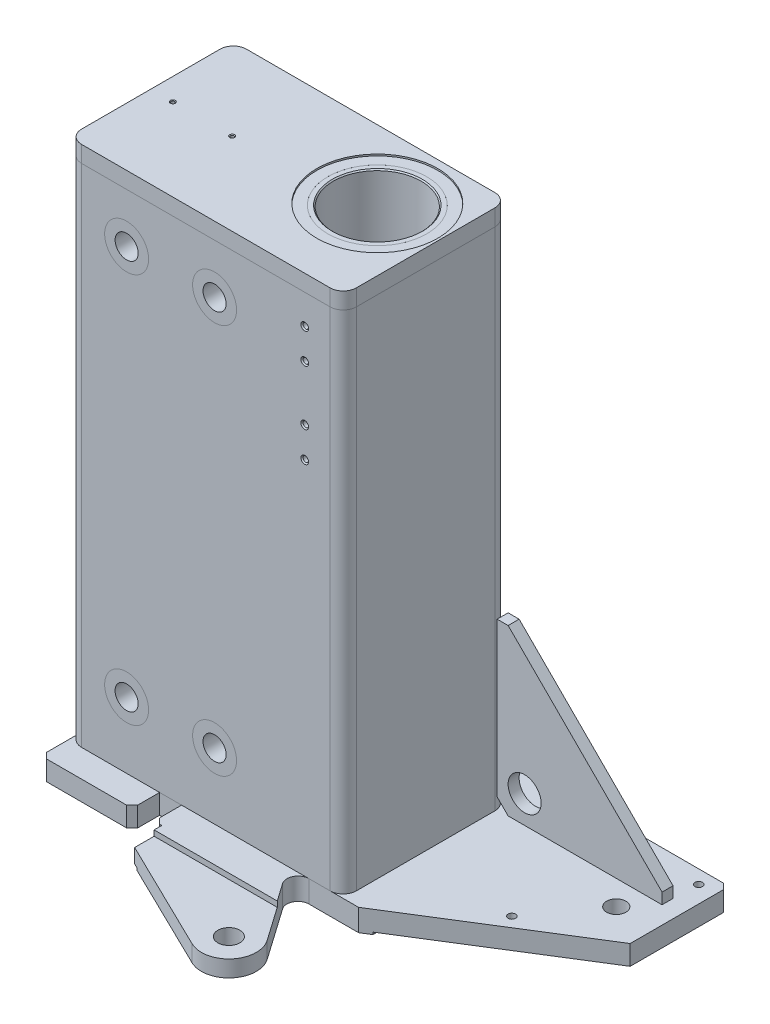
SolidWorks part; units mm, degrees
ref_plane "Face" through (0, 0, 0) normal (0, 0, 1) x (1, 0, 0)
ref_plane "Dessus" through (0, 0, 0) normal (0, 1, 0) x (1, 0, 0)
ref_plane "Droite" through (0, 0, 0) normal (1, 0, 0) x (0, 0, -1)
sketch "Esquisse1" plane through (0, 0, 0) normal (0, 1, 0) x (1, 0, 0)
  line L0 (125, 75) -> (-125, -75) construction
  line L1 (-113, 75) -> (113, 75)
  line L2 (-125, 63) -> (-125, -63)
  line L3 (-113, -75) -> (113, -75)
  line L4 (125, 63) -> (125, -63)
  line L6 (-113, 69) -> (113, 69)
  line L7 (-119, 63) -> (-119, -63)
  line L8 (-113, -69) -> (113, -69)
  line L9 (119, 63) -> (119, -63)
  arc A0 (-119, 63) -> (-113, 69) centre (-113, 63) cw
  arc A1 (119, 63) -> (113, 69) centre (113, 63) ccw
  arc A2 (113, -69) -> (119, -63) centre (113, -63) ccw
  arc A3 (-113, -69) -> (-119, -63) centre (-113, -63) cw
  arc A4 (-125, 63) -> (-113, 75) centre (-113, 63) cw
  arc A5 (-113, -75) -> (-125, -63) centre (-113, -63) cw
  arc A6 (125, -63) -> (113, -75) centre (113, -63) cw
  arc A7 (113, 75) -> (125, 63) centre (113, 63) cw
  dimension "D7" = 6
  dimension "D8" = 12
  dimension "D1" = 250
  dimension "D2" = 150
  dimension "D3" = 6
  dimension "D4" = 6
  dimension "D5" = 6
  dimension "D6" = 6
extrude "Extrusion1" add sketch "Esquisse1" against normal blind 460
sketch "Esquisse2" plane through (0, 0, 0) normal (0, 1, 0) x (-1, 0, 0)
  line L4 (125, -63) -> (125, 63)
  line L5 (113, 75) -> (-113, 75)
  line L6 (-125, 63) -> (-125, -63)
  line L7 (-113, -75) -> (113, -75)
  line L8 (125, -63) -> (125, 63)
  line L9 (113, 75) -> (-113, 75)
  line L10 (-125, 63) -> (-125, -63)
  line L11 (-113, -75) -> (113, -75)
  circle A0 centre (-68, -13) radius 45
  arc A4 (113, -75) -> (125, -63) centre (113, -63) ccw
  arc A5 (125, 63) -> (113, 75) centre (113, 63) ccw
  arc A6 (-113, 75) -> (-125, 63) centre (-113, 63) ccw
  arc A7 (-125, -63) -> (-113, -75) centre (-113, -63) ccw
  arc A8 (113, -75) -> (125, -63) centre (113, -63) ccw
  arc A9 (125, 63) -> (113, 75) centre (113, 63) ccw
  arc A10 (-113, 75) -> (-125, 63) centre (-113, 63) ccw
  arc A11 (-125, -63) -> (-113, -75) centre (-113, -63) ccw
  dimension "D2" = 90
  dimension "D3" = 68
  dimension "D4" = 88
  dimension "D1" = 0
extrude "Extrusion2" add sketch "Esquisse2" along normal blind 15 separate body
sketch "Esquisse3" plane through (0, -460, 0) normal (0, -1, 0) x (1, 0, 0)
  line L0 (-113, -75) -> (15.8579, -75)
  line L1 (113, -75) -> (-113, -75) construction
  line L2 (-125, 100) -> (-67.9538, 100)
  line L3 (-63.5701, 101.0121) -> (87.0407, 174.4699)
  line L4 (-113, -75) -> (113, -75)
  line L5 (125, -63) -> (125, 63)
  line L6 (113, 75) -> (-113, 75)
  line L7 (-125, 63) -> (-125, -63)
  line L8 (291, -20) -> (291, -110)
  line L9 (93.8132, 75) -> (138.9682, 75)
  line L10 (118.4788, 137.6606) -> (85.6217, 90.7358)
  line L11 (-125, 100) -> (-125, -63)
  line L12 (138.9682, 75) -> (291, -20)
  line L13 (22.9289, -77.9289) -> (55, -110)
  line L14 (55, -110) -> (291, -110)
  circle A0 centre (68, -13) radius 45 construction
  circle A1 centre (68, -13) radius 45
  arc A2 (-113, -75) -> (-125, -63) centre (-113, -63) cw
  arc A3 (-63.5701, 101.0121) -> (-67.9538, 100) centre (-67.9538, 110) cw
  arc A4 (-125, -63) -> (-113, -75) centre (-113, -63) ccw
  arc A5 (113, -75) -> (125, -63) centre (113, -63) ccw
  arc A6 (125, 63) -> (113, 75) centre (113, 63) ccw
  arc A7 (-113, 75) -> (-125, 63) centre (-113, 63) ccw
  arc A8 (93.8132, 75) -> (85.6217, 90.7358) centre (93.8132, 85) cw
  circle A9 centre (98, 152) radius 10
  arc A10 (118.4788, 137.6606) -> (87.0407, 174.4699) centre (98, 152) ccw
  arc A11 (22.9289, -77.9289) -> (15.8579, -75) centre (15.8579, -85) ccw
  point P28 (-65.6451, 100)
  point P39 (20, -75)
  dimension "D2" = 12
  dimension "D3" = 165
  dimension "D6" = 20
  dimension "D5" = 25
  dimension "D10" = 150
  dimension "D8" = 10
  dimension "D7" = 10
  dimension "D18" = 10
  dimension "D4" = 175
  dimension "D9" = 30
  dimension "D11" = 223
  dimension "D12" = 55
  dimension "D13" = 55
  dimension "D14" = 32
  dimension "D15" = 145
  dimension "D16" = 135
  dimension "D17" = 210
  dimension "D19" = 29
  dimension "D1" = 0
extrude "Extrusion3" add sketch "Esquisse3" along normal blind 20 separate body
sketch "Esquisse21" plane through (0, 15, 0) normal (0, 1, 0) x (-1, 0, 0)
  point P0 (-68, -13)
ref_plane "Plan1" through (0, 0, -13) normal (0, 0, 1) x (1, 0, 0)
sketch "Esquisse4" plane through (0, 0, -13) normal (0, 0, 1) x (1, 0, 0)
  line L0 (68, -415) -> (68, -522.3182) construction
  line L1 (-67.9538, -480) -> (-125, -480) construction
  line L2 (-113, 15) -> (113, 15) construction
  line L3 (20.5, 0) -> (20.5, -460)
  line L4 (23, -480) -> (28, -480)
  line L5 (87.0407, -460) -> (-63.5701, -460) construction
  line L6 (20.5, -460) -> (23, -460)
  line L7 (28, 15) -> (23, 15)
  line L8 (28, 15) -> (28, -45)
  line L9 (28, -45) -> (29.5, -45)
  line L10 (29.5, -45) -> (29.5, -420)
  line L11 (29.5, -420) -> (28, -420)
  line L12 (28, -420) -> (28, -480)
  line L13 (-113, 0) -> (113, 0) construction
  line L15 (23, -460) -> (23, -480)
  line L17 (20.5, 0) -> (23, 0)
  line L18 (23, 15) -> (23, 0)
  dimension "D1" = 68
  dimension "D2" = 60
  dimension "D3" = 60
  dimension "D4" = 80
  dimension "D5" = 95
  dimension "D6" = 77
  dimension "D7" = 90
revolve "Révolution1" add sketch "Esquisse4" angle 360 about L0
sketch "Esquisse22" plane through (0, 0, -13) normal (0, 0, 1) x (1, 0, 0)
  line L0 (-113, 15) -> (113, 15) construction
  line L1 (17.9, -26) -> (27.9, -26)
  line L2 (17.9, -26) -> (17.9, -64)
  line L3 (17.9, -64) -> (27.9, -64)
  line L4 (27.9, -26) -> (27.9, -64)
  line L6 (17.9, -381) -> (27.9, -381)
  line L7 (17.9, -381) -> (17.9, -419)
  line L8 (17.9, -419) -> (27.9, -419)
  line L9 (27.9, -381) -> (27.9, -419)
  dimension "D1" = 38
  dimension "D2" = 10
  dimension "D3" = 38
  dimension "D4" = 10
  dimension "D5" = 27.9
  dimension "D6" = 41
  dimension "D7" = 317
extrude "Enlèv. mat.-Extru.11" cut sketch "Esquisse22" against normal blind 50 and the other way blind 50
sketch "Esquisse5" plane through (0, 0, 0) normal (0, 0, 1) x (1, 0, 0)
  line L1 (-125, -460) -> (-125, 0) construction
  line L3 (-67.9538, -480) -> (-125, -480) construction
  circle A0 centre (-72, -45) radius 20
  circle A1 centre (8, -45) radius 20
  circle A2 centre (-72, -400) radius 20
  circle A3 centre (8, -400) radius 20
  dimension "D1" = 40
  dimension "D4" = 355
  dimension "D2" = 80
  dimension "D3" = 80
  dimension "D5" = 53
extrude "Enlèv. mat.-Extru.1" cut sketch "Esquisse5" against normal mid plane 150
sketch "Esquisse6" plane through (0, 0, 0) normal (0, 0, 1) x (1, 0, 0)
  circle A0 centre (-72, -45) radius 10.5
  circle A1 centre (8, -45) radius 10.5
  circle A2 centre (-72, -400) radius 10.5
  circle A3 centre (8, -400) radius 10.5
  circle A4 centre (-72, -45) radius 20 construction
  circle A5 centre (8, -45) radius 20 construction
  circle A6 centre (8, -400) radius 20 construction
  circle A7 centre (-72, -400) radius 20 construction
  circle A8 centre (-72, -45) radius 20
  circle A9 centre (8, -45) radius 20
  circle A10 centre (8, -400) radius 20
  circle A11 centre (-72, -400) radius 20
  dimension "D1" = 21
  dimension "D2" = 21
  dimension "D3" = 21
  dimension "D4" = 21
extrude "Extrusion4" add sketch "Esquisse6" along normal mid plane 150 separate body
chamfer "Chanfrein1" distance 5 angle 45 2 edges at (-125, -470, 100) (291, -470, -110)
sketch "Esquisse7" plane through (0, -460, 0) normal (0, -1, 0) x (1, 0, 0)
  line L0 (97.01, 107) -> (-51.293, 107)
  line L2 (87.0407, 174.4699) -> (-63.5701, 101.0121) construction
  line L3 (85.6217, 90.7358) -> (118.4788, 137.6606) construction
  line L4 (97.01, 107) -> (118.4788, 137.6606)
  line L5 (87.0407, 174.4699) -> (-63.5701, 101.0121) construction
  line L8 (87.0407, 174.4699) -> (-51.293, 107)
  arc A1 (118.4788, 137.6606) -> (87.0407, 174.4699) centre (98, 152) ccw construction
  arc A2 (118.4788, 137.6606) -> (87.0407, 174.4699) centre (98, 152) ccw
  dimension "D1" = 45
extrude "Enlèv. mat.-Extru.2" cut sketch "Esquisse7" along normal blind 5 from surface at 0
sketch "Esquisse8" plane through (0, -460, 0) normal (0, 1, 0) x (-1, 0, 0)
  line L0 (67.9538, 100) -> (120, 100) construction
  line L1 (22, 100) -> (42, 100)
  line L2 (22, 100) -> (22, 75)
  line L3 (22, 75) -> (42, 75)
  line L4 (42, 100) -> (42, 75)
  line L5 (113, 75) -> (-113, 75) construction
  line L6 (32, 143.1747) -> (32, 56.8253) construction
  line L7 (72, 75) -> (72, -75) construction
  dimension "D1" = 20
  dimension "D2" = 40
extrude "Enlèv. mat.-Extru.3" cut sketch "Esquisse8" against normal through all
sketch "Esquisse9" plane through (0, 15, 0) normal (0, 1, 0) x (-1, 0, 0)
  circle A0 centre (-68, -13) radius 55
  circle A1 centre (-68, -13) radius 47.5 construction
  dimension "D1" = 110
extrude "Enlèv. mat.-Extru.4" cut sketch "Esquisse9" against normal blind 1.5
sketch "Esquisse10" plane through (0, -480, 0) normal (0, -1, 0) x (1, 0, 0)
  circle A0 centre (68, -13) radius 55
  circle A1 centre (68, -13) radius 47.5 construction
  dimension "D1" = 110
extrude "Enlèv. mat.-Extru.5" cut sketch "Esquisse10" against normal blind 1.5
chamfer "Chanfrein3" distance 1 angle 45 2 edges at (68, 13.5, 27) (68, -478.5, -53)
ref_plane "Plan2" through (68, 0, 0) normal (-1, 0, 0) x (0, 0, 1)
surface "Surface-Décalage1" parameters "D1"=0
other "Enlèv. mat.-Surface1" [suppressed]
sketch "Esquisse13" plane through (0, -480, 0) normal (0, -1, 0) x (1, 0, 0)
  line L0 (-113, -75) -> (15.8579, -75) construction
  line L1 (-125, -75) -> (-11, -75)
  line L2 (-125, -75) -> (-125, 150.8001)
  line L4 (-11, -75) -> (-11, 150.8001)
  line L6 (-125, 95) -> (-125, -63) construction
  line L7 (147, -110) -> (147, 100)
  line L8 (-125, 150.8001) -> (-11, 150.8001)
  line L9 (55, -110) -> (286, -110) construction
  line L10 (147, 100) -> (291, 100)
  line L11 (291, -105) -> (291, -20) construction
  line L12 (55, -110) -> (286, -110) construction
  line L13 (147, -110) -> (291, -110)
  line L15 (291, -110) -> (291, 100)
  circle A0 centre (68, -13) radius 38.5 construction
  dimension "D1" = 79
  dimension "D2" = 79
extrude "Enlèv. mat.-Extru.7" cut sketch "Esquisse13" against normal blind 2
sketch "Esquisse14" plane through (0, -478, 0) normal (0, -1, 0) x (1, 0, 0)
  line L0 (68, -13) -> (-164.512, -13) construction
  line L1 (68, -13) -> (68, 197.8369) construction
  line L2 (-159.34, 22.9636) -> (301.8703, -49.9966) construction
  arc A0 (-81.9709, -68.7561) -> (-71.1946, 65.8978) centre (68, -13) cw construction
  arc A1 (251.0242, 38.0113) -> (238.2829, -97.2837) centre (68, -13) cw construction
  point P4 (-90.0348, 12)
  point P8 (255.6663, -42.6875)
  dimension "D1" = 160
  dimension "D3" = 190
  dimension "D2" = 25
hole_wizard "Trou taraudé M20x2.51" positions "Esquisse3D1" profile "Esquisse15" tap size "M20x2.5" standard "Ansi Métrique"
sketch3d "Esquisse3D1"
  point P0 (-90.0348, -478, 12)
  point P12 (617.5675, -73.1028, 0)
  point P13 (255.6663, -478, -42.6875)
sketch "Esquisse15" plane through (-90.0348, -478, 12) normal (1, 0, 0) x (0, 0, -1)
  line L0 (0, 0) -> (0, 18)
  line L1 (0, 18) -> (8.75, 18)
  line L2 (8.75, 18) -> (8.75, 0)
  line L5 (8.75, 0) -> (0, 0)
  line L11 (0, -6.35) -> (0, 107.95) construction
  dimension "Diamètre du trou pour taraudage jusqu'au prochain" = 17.5
  dimension "Profondeur du trou pour taraudage jusqu'au prochain" = 18
sketch "Esquisse18" plane through (0, -478, 0) normal (0, -1, 0) x (1, 0, 0)
  circle A0 centre (-90.0348, 12) radius 8.75 construction
  point P0 (-110.0348, 67)
  point P1 (-50.0348, -43)
  point P4 (275.6663, -97.6875)
  point P5 (215.6663, 12.3125)
  dimension "D1" = 60
  dimension "D2" = 20
  dimension "D3" = 110
  dimension "D4" = 55
  dimension "D5" = 55
  dimension "D6" = 20
  dimension "D7" = 60
  dimension "D8" = 110
hole_wizard "Trou taraudé M8x1.251" positions "Esquisse3D3" profile "Esquisse19" tap size "M8x1.25" standard "Ansi Métrique"
sketch3d "Esquisse3D3"
  point P0 (-110.0348, -478, 67)
  point P3 (-50.0348, -478, -43)
  point P6 (215.6663, -478, 12.3125)
  point P9 (275.6663, -478, -97.6875)
sketch "Esquisse19" plane through (-110.0348, -478, 67) normal (1, 0, 0) x (0, 0, -1)
  line L0 (0, 0) -> (0, 18)
  line L1 (0, 18) -> (3.4, 18)
  line L2 (3.4, 18) -> (3.4, 0)
  line L5 (3.4, 0) -> (0, 0)
  line L11 (0, -6.35) -> (0, 107.95) construction
  dimension "Diamètre du trou pour taraudage jusqu'au prochain" = 6.8
  dimension "Profondeur du trou pour taraudage jusqu'au prochain" = 18
sketch "Esquisse20" plane through (0, 0, 0) normal (0, 0, 1) x (1, 0, 0)
  line L0 (135, -310) -> (125, -310)
  line L1 (125, -460) -> (125, 0) construction
  line L2 (125, -310) -> (125, -450)
  line L3 (125, -450) -> (135, -460)
  line L4 (138.9682, -460) -> (93.8132, -460) construction
  line L5 (135, -460) -> (275, -460)
  line L6 (275, -450) -> (275, -460)
  line L7 (135, -310) -> (275, -450)
  dimension "D1" = 10
  dimension "D2" = 10
  dimension "D3" = 150
  dimension "D4" = 10
  dimension "D5" = 150
  dimension "D6" = 10
extrude "Extrusion5" add sketch "Esquisse20" against normal blind 10 from offset 65 separate body
sketch "Esquisse23" plane through (0, -460, 0) normal (0, 1, 0) x (-1, 0, 0)
  line L0 (22, 100) -> (22, 132.413)
  line L1 (22, 132.413) -> (61.4163, 132.413)
  line L2 (61.4163, 132.413) -> (77.1698, 100)
  line L3 (67.9538, 100) -> (120, 100) construction
  line L4 (77.1698, 100) -> (22, 100)
extrude "Enlèv. mat.-Extru.12" cut sketch "Esquisse23" against normal through all
chamfer "Chanfrein4" distance 5 angle 45 1 edges at (-42, -469, 100)
hole_wizard "Trou taraudé M41" positions "Esquisse3D5" profile "Esquisse25" tap size "M4" standard "ISO"
sketch3d "Esquisse3D5"
  point P0 (-51, 15, 0)
  point P2 (-105, 15, 0)
  dimension "D1" = 75
  dimension "D2" = 75
  dimension "D3" = 54
  dimension "D4" = 20
sketch "Esquisse25" plane through (-51, 15, 0) normal (1, 0, 0) x (0, 0, 1)
  line L0 (0, 0) -> (0, 14.4914)
  line L1 (0, 14.4914) -> (1.65, 13.5)
  line L2 (1.65, 13.5) -> (1.65, 0.6)
  line L3 (1.65, 0.6) -> (2.25, 0)
  line L5 (2.25, 0) -> (0, 0)
  line L6 (-1.65, 0.6) -> (-2.25, 0) construction
  line L10 (0, 14.4914) -> (-1.65, 13.5) construction
  line L11 (0, -6.35) -> (0, 107.95) construction
  dimension "Diamètre du trou pour taraudage" = 3.3
  dimension "Profondeur du trou pour taraudage" = 13.5
  dimension "Diamètre du fraisage entrant" = 4.5
  dimension "Angle du fraisage entrant" = 90
  dimension "Angle de pointe" = 118
hole_wizard "Trou taraudé M63" positions "Esquisse3D6" profile "Esquisse26" tap size "M6" standard "ISO"
sketch3d "Esquisse3D6"
  point P0 (90, -27, -75)
  point P2 (90, -132, -75)
  dimension "D1" = 42
  dimension "D2" = 35
  dimension "D3" = 105
sketch "Esquisse26" plane through (90, -27, -75) normal (1, 0, 0) x (0, 1, 0)
  line L0 (0, 0) -> (0, 18.5022)
  line L1 (0, 18.5022) -> (2.5, 17)
  line L2 (2.5, 17) -> (2.5, 1)
  line L3 (2.5, 1) -> (3.5, 0)
  line L5 (3.5, 0) -> (0, 0)
  line L6 (-2.5, 1) -> (-3.5, 0) construction
  line L10 (0, 18.5022) -> (-2.5, 17) construction
  line L11 (0, -6.35) -> (0, 107.95) construction
  dimension "Diamètre du trou pour taraudage" = 5
  dimension "Profondeur du trou pour taraudage" = 17
  dimension "Diamètre du fraisage entrant" = 7
  dimension "Angle du fraisage entrant" = 90
  dimension "Angle de pointe" = 118
hole_wizard "Trou taraudé M64" positions "Esquisse3D7" profile "Esquisse27" tap size "M6" standard "ISO"
sketch3d "Esquisse3D7"
  point P0 (90, -27, 75)
  point P2 (90, -132, 75)
  dimension "D1" = 42
  dimension "D2" = 35
  dimension "D3" = 105
sketch "Esquisse27" plane through (90, -27, 75) normal (1, 0, 0) x (0, -1, 0)
  line L0 (0, 0) -> (0, 18.5022)
  line L1 (0, 18.5022) -> (2.5, 17)
  line L2 (2.5, 17) -> (2.5, 1)
  line L3 (2.5, 1) -> (3.5, 0)
  line L5 (3.5, 0) -> (0, 0)
  line L6 (-2.5, 1) -> (-3.5, 0) construction
  line L10 (0, 18.5022) -> (-2.5, 17) construction
  line L11 (0, -6.35) -> (0, 107.95) construction
  dimension "Diamètre du trou pour taraudage" = 5
  dimension "Profondeur du trou pour taraudage" = 17
  dimension "Diamètre du fraisage entrant" = 7
  dimension "Angle du fraisage entrant" = 90
  dimension "Angle de pointe" = 118
hole_wizard "Trou taraudé M61" positions "Esquisse3D8" profile "Esquisse28" tap size "M6" standard "ISO"
sketch3d "Esquisse3D8"
  point P0 (90, -54.5, -75)
  point P2 (90, -104.5, -75)
  dimension "D1" = 69.5
  dimension "D2" = 50
  dimension "D3" = 35
sketch "Esquisse28" plane through (90, -54.5, -75) normal (1, 0, 0) x (0, 1, 0)
  line L0 (0, 0) -> (0, 18.5022)
  line L1 (0, 18.5022) -> (2.5, 17)
  line L2 (2.5, 17) -> (2.5, 1)
  line L3 (2.5, 1) -> (3.5, 0)
  line L5 (3.5, 0) -> (0, 0)
  line L6 (-2.5, 1) -> (-3.5, 0) construction
  line L10 (0, 18.5022) -> (-2.5, 17) construction
  line L11 (0, -6.35) -> (0, 107.95) construction
  dimension "Diamètre du trou pour taraudage" = 5
  dimension "Profondeur du trou pour taraudage" = 17
  dimension "Diamètre du fraisage entrant" = 7
  dimension "Angle du fraisage entrant" = 90
  dimension "Angle de pointe" = 118
hole_wizard "Trou taraudé M62" positions "Esquisse3D9" profile "Esquisse29" tap size "M6" standard "ISO"
sketch3d "Esquisse3D9"
  point P0 (90, -54.5, 75)
  point P2 (90, -104.5, 75)
  dimension "D1" = 35
  dimension "D2" = 69.5
  dimension "D3" = 50
sketch "Esquisse29" plane through (90, -54.5, 75) normal (1, 0, 0) x (0, -1, 0)
  line L0 (0, 0) -> (0, 18.5022)
  line L1 (0, 18.5022) -> (2.5, 17)
  line L2 (2.5, 17) -> (2.5, 1)
  line L3 (2.5, 1) -> (3.5, 0)
  line L5 (3.5, 0) -> (0, 0)
  line L6 (-2.5, 1) -> (-3.5, 0) construction
  line L10 (0, 18.5022) -> (-2.5, 17) construction
  line L11 (0, -6.35) -> (0, 107.95) construction
  dimension "Diamètre du trou pour taraudage" = 5
  dimension "Profondeur du trou pour taraudage" = 17
  dimension "Diamètre du fraisage entrant" = 7
  dimension "Angle du fraisage entrant" = 90
  dimension "Angle de pointe" = 118
sketch "Esquisse30" plane through (0, -460, 0) normal (0, 1, 0) x (-1, 0, 0)
  line L0 (22, 95) -> (17, 100)
  line L1 (22, 107) -> (22, 75) construction
  line L2 (17, 100) -> (15, 100)
  line L3 (15, 100) -> (15, 124.7013)
  line L4 (-87.0407, 174.4699) -> (22, 121.2871) construction
  line L5 (15, 124.7013) -> (22, 121.2871)
  line L6 (22, 121.2871) -> (22, 95)
  line L7 (113, 75) -> (-113, 75) construction
  dimension "D1" = 20
  dimension "D2" = 5
  dimension "D3" = 45
  dimension "D4" = 2
extrude "Enlèv. mat.-Extru.13" cut sketch "Esquisse30" against normal through all
hole_wizard "Trou taraudé M101" positions "Esquisse3D10" profile "Esquisse31" tap size "M10" standard "ISO"
sketch3d "Esquisse3D10"
  point P0 (18, -95, -75)
  point P2 (-82, -95, -75)
  point P4 (18, -225, -75)
  point P6 (-82, -225, -75)
  dimension "D1" = 130
  dimension "D2" = 100
  dimension "D3" = 43
  dimension "D4" = 110
sketch "Esquisse31" plane through (18, -95, -75) normal (1, 0, 0) x (0, 1, 0)
  line L0 (0, 0) -> (0, 30.0537)
  line L1 (0, 30.0537) -> (4.25, 27.5)
  line L2 (4.25, 27.5) -> (4.25, 1.25)
  line L3 (4.25, 1.25) -> (5.5, 0)
  line L5 (5.5, 0) -> (0, 0)
  line L6 (-4.25, 1.25) -> (-5.5, 0) construction
  line L10 (0, 30.0537) -> (-4.25, 27.5) construction
  line L11 (0, -6.35) -> (0, 107.95) construction
  dimension "Diamètre du trou pour taraudage" = 8.5
  dimension "Profondeur du trou pour taraudage" = 27.5
  dimension "Diamètre du fraisage entrant" = 11
  dimension "Angle du fraisage entrant" = 90
  dimension "Angle de pointe" = 118
sketch "Esquisse32" plane through (0, 0, -75) normal (0, 0, -1) x (-1, 0, 0)
  line L0 (-135, -460) -> (-275, -460) construction
  line L1 (-125, -310) -> (-125, -450) construction
  circle A0 centre (-150, -435) radius 15
  dimension "D1" = 30
  dimension "D2" = 25
  dimension "D3" = 25
extrude "Enlèv. mat.-Extru.14" cut sketch "Esquisse32" against normal through all
